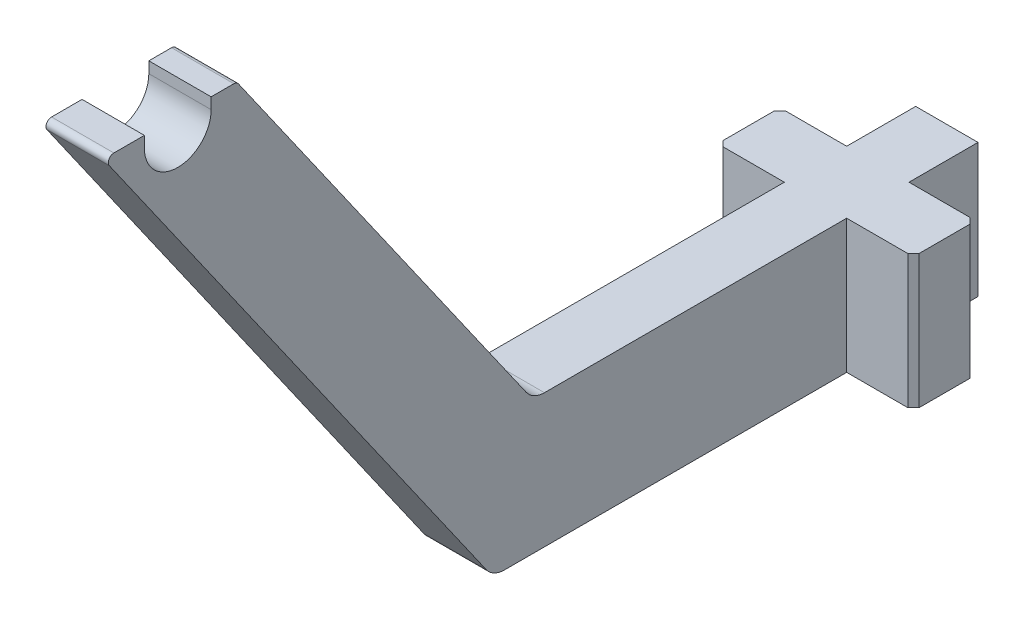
SolidWorks part; units mm, degrees
ref_plane "前视基准面" through (0, 0, 0) normal (0, 0, 1) x (1, 0, 0)
ref_plane "上视基准面" through (0, 0, 0) normal (0, 1, 0) x (1, 0, 0)
ref_plane "右视基准面" through (0, 0, 0) normal (1, 0, 0) x (0, 0, -1)
sketch "草图1" plane through (0, 0, 0) normal (1, 0, 0) x (0, 0, -1)
  line L0 (0, 0) -> (0, 6)
  line L1 (0, 6) -> (-20, 6)
  line L2 (-20, 6) -> (-33.3039, 25)
  line L3 (0, 0) -> (-21.7988, 0)
  line L4 (-21.7988, 0) -> (-39.3039, 25)
  line L5 (-39.3039, 25) -> (-33.3039, 25)
  dimension "D1" = 125
  dimension "D2" = 6
  dimension "D3" = 25
  dimension "D4" = 20
  dimension "D5" = 6
extrude "凸台-拉伸1" add sketch "草图1" along normal mid plane 2.8
sketch "草图2" plane through (0, 6, 0) normal (0, 1, 0) x (1, 0, 0)
  line L0 (-9.6073, -4.5) -> (8.8025, -4.5) construction
  line L1 (-1.4, -3.1) -> (-4.4, -3.1)
  line L2 (-1.4, 0) -> (-1.4, -20) construction
  line L3 (-4.4, -3.1) -> (-4.4, -5.9)
  line L4 (-4.4, -5.9) -> (-1.4, -5.9)
  line L5 (-1.4, -5.9) -> (-1.4, -3.1)
  line L6 (0, 3.2996) -> (0, -7.6258) construction
  line L7 (1.4, -5.9) -> (1.4, -3.1)
  line L8 (4.4, -5.9) -> (1.4, -5.9)
  line L9 (4.4, -3.1) -> (4.4, -5.9)
  line L10 (1.4, -3.1) -> (4.4, -3.1)
  dimension "D1" = 4.5
  dimension "D2" = 3
  dimension "D3" = 2.8
extrude "凸台-拉伸2" add sketch "草图2" against normal up to surface (6 mm away)
sketch "草图3" plane through (-1.4, 0, 0) normal (-1, 0, 0) x (0, 0, 1)
  line L1 (28.188, 13.4093) -> (25.2233, 9.1752) construction
  line L2 (20, 6) -> (33.3039, 25) construction
  line L3 (33.3039, 25) -> (39.3039, 25) construction
  line L4 (19.1527, 24.5) -> (22.4741, 24.5) construction
  line L5 (34.4538, 24.5) -> (34.4538, 25)
  line L6 (34.4538, 25) -> (37.4538, 25)
  line L7 (37.4538, 25) -> (37.4538, 24.5)
  arc A0 (34.4538, 24.5) -> (37.4538, 24.5) centre (35.9538, 24.5) ccw
  point P6 (36.3039, 25)
  dimension "D1" = 3
  dimension "D2" = 0.5
extrude "切除-拉伸1" cut sketch "草图3" against normal through all
fillet "圆角1" radius 1 2 edges at (0, 6, 20) (0, 0, 21.7988)
fillet "圆角2" radius 0.25 2 edges at (0, 25, 39.3039) (0, 25, 33.3039)
chamfer "倒角1" distance 0.25 angle 45 4 edges at (-4.4, 3, 5.9) (-4.4, 3, 3.1) (4.4, 3, 5.9) (4.4, 3, 3.1)
